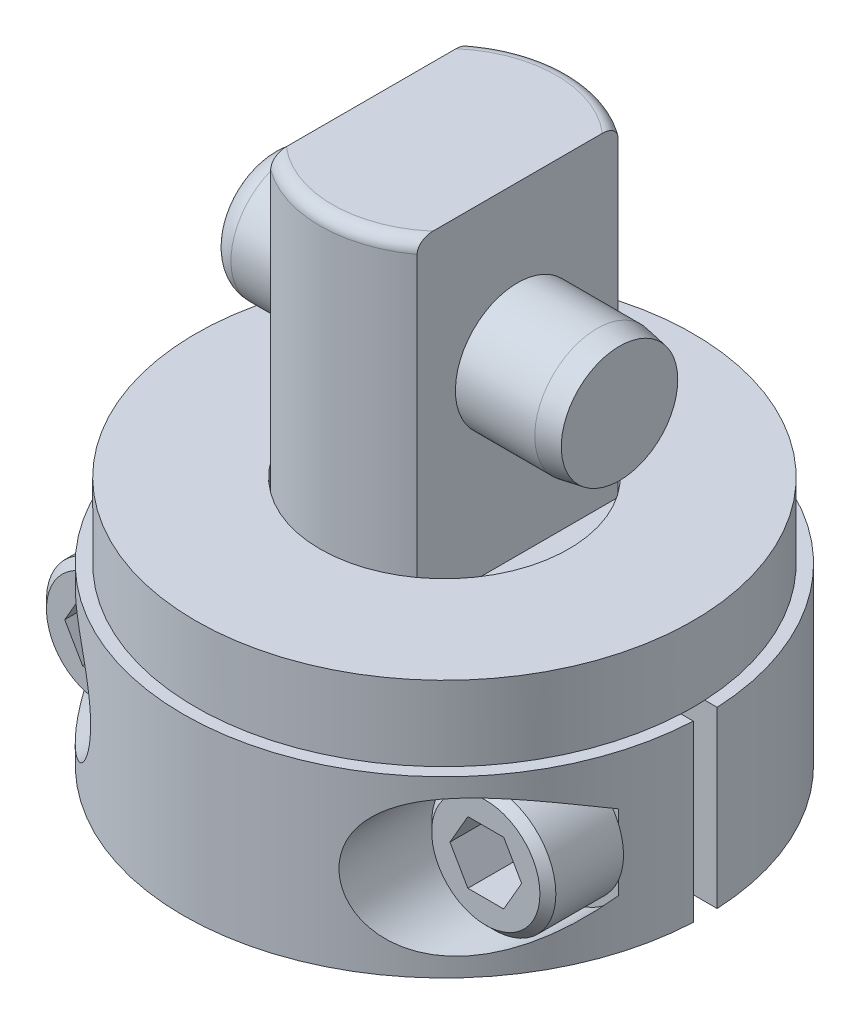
SolidWorks part; units mm, degrees
ref_plane "Front Plane" through (0, 0, 0) normal (0, 0, 1) x (1, 0, 0)
ref_plane "Top Plane" through (0, 0, 0) normal (0, 1, 0) x (1, 0, 0)
ref_plane "Right Plane" through (0, 0, 0) normal (1, 0, 0) x (0, 0, -1)
sketch "Sketch1" plane through (0, 0, 0) normal (1, 0, 0) x (0, 0, -1)
  line L0 (0, 28.9814) -> (7.9375, 28.9814)
  line L1 (7.9375, 28.9814) -> (7.9375, 0)
  line L2 (7.9375, 0) -> (4.7625, 0)
  line L3 (4.7625, 0) -> (4.7625, -11.176)
  line L4 (4.7625, -11.176) -> (0, -11.176)
  line L5 (0, -11.176) -> (0, 28.9814)
  line L6 (0, -15.3594) -> (0, 43.147) construction
  dimension "D1" = 40.1574
  dimension "D2" = 11.176
  dimension "D3" = 9.525
  dimension "D4" = 15.875
revolve "Revolve1" add sketch "Sketch1" angle 360 about L6
fillet "Fillet1" radius 0.7874 1 edges at (0, 28.9814, -7.9375)
sketch "Sketch2" plane through (0, 0, 0) normal (0, 0, 1) x (1, 0, 0)
  line L0 (4.6736, 28.9814) -> (7.9375, 28.9814)
  line L1 (7.9375, 28.9814) -> (7.9375, 8.3566)
  line L2 (7.9375, 8.3566) -> (4.6736, 8.3566)
  line L3 (4.6736, 8.3566) -> (4.6736, 28.9814)
  line L4 (-7.9375, 28.9814) -> (-4.6736, 28.9814)
  line L5 (-4.6736, 28.9814) -> (-4.6736, 8.3566)
  line L6 (-4.6736, 8.3566) -> (-7.9375, 8.3566)
  line L7 (-7.9375, 8.3566) -> (-7.9375, 28.9814)
  line L8 (0, 5.9766) -> (0, 42.131) construction
  line L9 (7.1501, 28.9814) -> (-7.1501, 28.9814) construction
  line L10 (7.9375, 0) -> (7.9375, 28.194) construction
  line L11 (-7.9375, 28.194) -> (-7.9375, 0) construction
  dimension "D1" = 9.3472
  dimension "D2" = 20.6248
extrude "Cut-Extrude1" cut sketch "Sketch2" against normal through all and the other way through all
sketch "Sketch3" plane through (0, 0, 0) normal (0, -1, 0) x (1, 0, 0)
  circle A0 centre (0, 0) radius 4.064
  circle A1 centre (0, 0) radius 4.7625 construction
  circle A2 centre (0, 0) radius 4.7625
  dimension "D1" = 8.128
extrude "Cut-Extrude2" cut sketch "Sketch3" along normal blind 2.54
chamfer "Chamfer1" distance 0.762 angle 45 1 edges at (0, -11.176, -4.7625)
sketch "Sketch4" plane through (0, 0, 0) normal (1, 0, 0) x (0, 0, -1)
  line L0 (-7.9375, 0) -> (7.9375, 0) construction
  circle A0 centre (0, 19.4564) radius 3.9713
  dimension "D1" = 7.9426
  dimension "D2" = 19.4564
extrude "Extrude1" add sketch "Sketch4" along normal mid plane 22.352
chamfer "Chamfer2" distance 0.254 angle 80 1 edges at (11.176, 19.4564, -3.9713)
fillet "Fillet2" radius 1.524 1 edges at (-11.176, 19.4564, -3.9713)
sketch "Sketch5" plane through (0, 0, 0) normal (0, 1, 0) x (1, 0, 0)
  line L0 (7.9008, 0.762) -> (16.645, 0.762)
  line L1 (7.9008, -0.762) -> (16.645, -0.762)
  line L2 (-7.9008, -0.762) -> (-16.645, -0.762)
  line L3 (-7.9008, 0.762) -> (-16.645, 0.762)
  line L4 (0, 0) -> (24.3028, 0) construction
  arc A0 (16.645, 0.762) -> (-16.645, 0.762) centre (0, 0) ccw
  arc A1 (-16.645, -0.762) -> (16.645, -0.762) centre (0, 0) ccw
  arc A2 (7.9008, 0.762) -> (-7.9008, 0.762) centre (0, 0) ccw
  arc A3 (-7.9008, -0.762) -> (7.9008, -0.762) centre (0, 0) ccw
  circle A4 centre (0, 0) radius 7.9375 construction
  dimension "D2" = 16.6624
  dimension "D1" = 1.524
extrude "Extrude2" add sketch "Sketch5" along normal blind 5.5626 and the other way blind 5.5626
sketch "Sketch6" plane through (0, 0, 0.762) normal (0, 0, 1) x (1, 0, 0)
  line L0 (0, -5.6718) -> (0, 5.6718) construction
  line L1 (-16.645, -5.5626) -> (16.645, -5.5626) construction
  circle A0 centre (12.2936, 0) radius 4.3688
  circle A1 centre (-12.2936, 0) radius 4.3688
  dimension "D1" = 8.7376
  dimension "D2" = 24.5872
  dimension "D3" = 5.5626
extrude "Cut-Extrude3" cut sketch "Sketch6" along normal through all from offset 4.064
sketch "Sketch7" plane through (0, 0, 4.826) normal (0, 0, 1) x (1, 0, 0)
  circle A0 centre (12.2936, 0) radius 3.9624
  circle A1 centre (-12.2936, 0) radius 3.9624
  arc A3 (-15.9482, -2.3938) -> (-15.9482, 2.3938) centre (-12.2936, 0) ccw construction
  arc A4 (15.9482, 2.3938) -> (15.9482, -2.3938) centre (12.2936, 0) ccw construction
  dimension "D1" = 7.9248
extrude "Extrude3" add sketch "Sketch7" along normal blind 4.826
chamfer "Chamfer3" distance 0.508 angle 45 2 edges at (-8.3312, 0, 9.652) (16.256, 0, 9.652)
sketch "Sketch8" plane through (0, 0, 9.652) normal (0, 0, 1) x (1, 0, 0)
  line L0 (0, 0) -> (0, -21.769) construction
  line L1 (13.4374, 1.9812) -> (14.5813, 0)
  line L2 (11.1498, 1.9812) -> (13.4374, 1.9812)
  line L3 (10.0059, 0) -> (11.1498, 1.9812)
  line L4 (11.1498, -1.9812) -> (10.0059, 0)
  line L5 (13.4374, -1.9812) -> (11.1498, -1.9812)
  line L6 (14.5813, 0) -> (13.4374, -1.9812)
  line L8 (-14.5813, 0) -> (-13.4374, -1.9812)
  line L9 (-13.4374, -1.9812) -> (-11.1498, -1.9812)
  line L10 (-11.1498, -1.9812) -> (-10.0059, 0)
  line L11 (-10.0059, 0) -> (-11.1498, 1.9812)
  line L12 (-11.1498, 1.9812) -> (-13.4374, 1.9812)
  line L13 (-13.4374, 1.9812) -> (-14.5813, 0)
  circle A0 centre (-12.2936, 0) radius 1.9812 construction
  circle A1 centre (12.2936, 0) radius 1.9812 construction
  dimension "D2" = 3.9624
extrude "Cut-Extrude4" cut sketch "Sketch8" against normal blind 3.9624
sketch "Sketch10" plane through (0, 0, 0) normal (0, 0, 1) x (1, 0, 0)
  circle A0 centre (12.2936, 0) radius 2.413
  circle A1 centre (-12.2936, 0) radius 2.413
  circle A2 centre (-12.2936, 0) radius 3.9624 construction
  circle A3 centre (12.2936, 0) radius 3.9624 construction
  dimension "D1" = 4.826
extrude "Extrude4" add sketch "Sketch10" along normal up to next and the other way up to next
sketch "Sketch11" plane through (0, 5.5626, 0) normal (0, 1, 0) x (-1, 0, 0)
  circle A0 centre (0, 0) radius 15.875
  circle A1 centre (0, 0) radius 7.9375
  circle A3 centre (0, 0) radius 4.7625 construction
  dimension "D1" = 31.75
  dimension "D2" = 15.875
extrude "Extrude5" add sketch "Sketch11" along normal blind 4.7752
